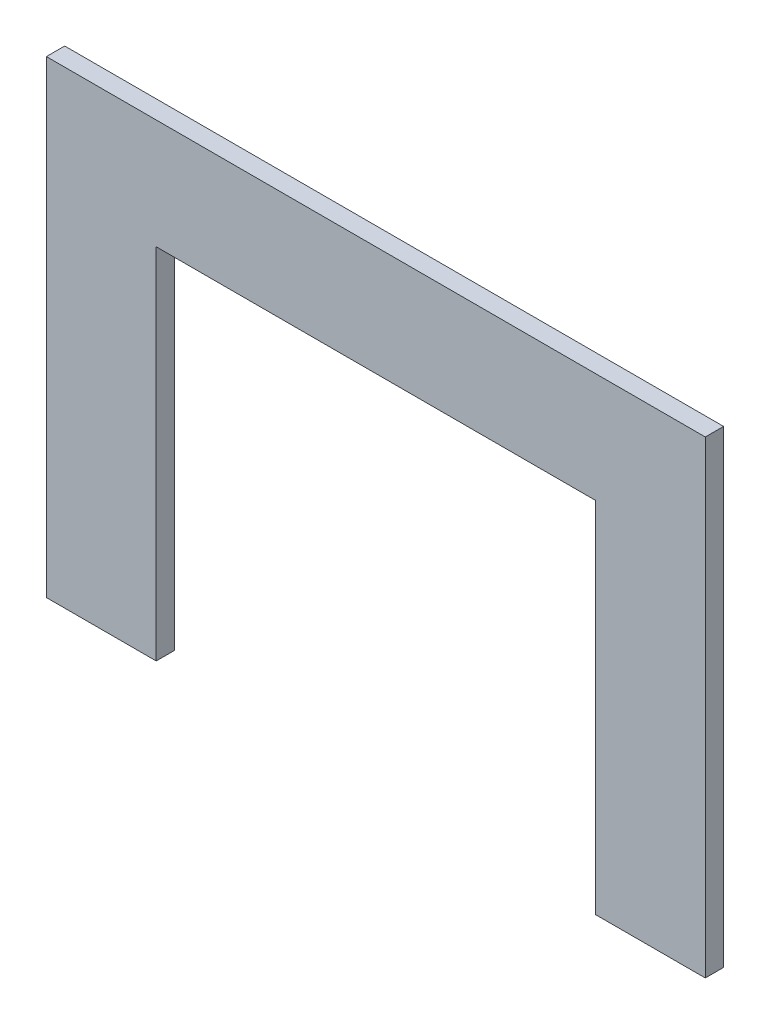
SolidWorks part; units mm, degrees
ref_plane "Plan de face" through (0, 0, 0) normal (0, 0, 1) x (1, 0, 0)
ref_plane "Plan de dessus" through (0, 0, 0) normal (0, 1, 0) x (1, 0, 0)
ref_plane "Plan de droite" through (0, 0, 0) normal (1, 0, 0) x (0, 0, -1)
sketch "Esquisse1" plane through (0, 0, 0) normal (0, 0, 1) x (1, 0, 0)
  line L0 (60, -64) -> (90, -64)
  line L1 (-90, 64) -> (90, 64)
  line L2 (-90, 64) -> (-90, -64)
  line L3 (-90, -64) -> (-60, -64)
  line L4 (90, 64) -> (90, -64)
  line L6 (-60, -64) -> (-60, 34)
  line L7 (-60, 34) -> (60, 34)
  line L8 (60, -64) -> (60, 34)
  point P4 (0, 64)
  point P5 (-90, 0)
  point P10 (0, 34)
  dimension "D1" = 180
  dimension "D2" = 128
  dimension "D3" = 120
  dimension "D4" = 98
extrude "Extrusion1" add sketch "Esquisse1" along normal blind 5
